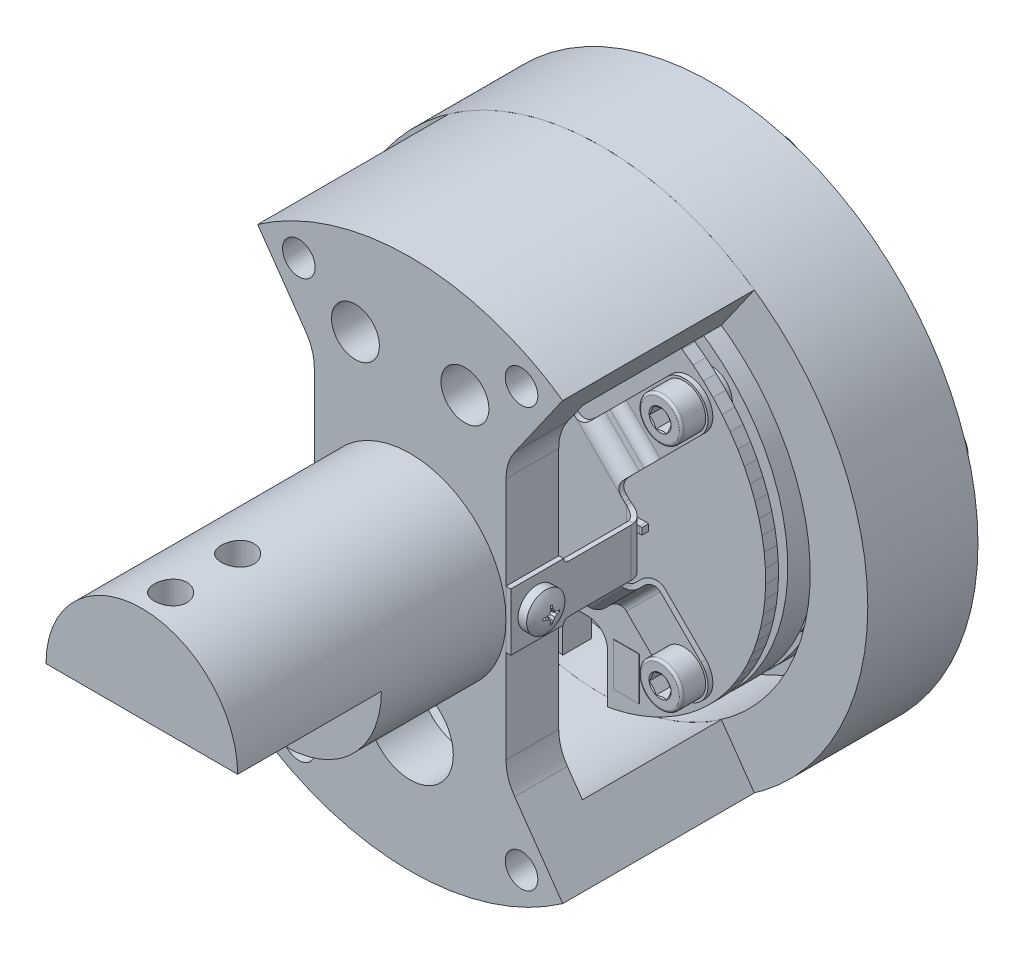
SolidWorks part; units mm, degrees
ref_plane "Plan de face" through (0, 0, 0) normal (0, 0, 1) x (1, 0, 0)
ref_plane "Plan de dessus" through (0, 0, 0) normal (0, 1, 0) x (1, 0, 0)
ref_plane "Plan de droite" through (0, 0, 0) normal (1, 0, 0) x (0, 0, -1)
imported_body "Importée1"
imported_body "Importée2"
imported_body "Importée3"
imported_body "Importée4"
imported_body "Importée5"
imported_body "Importée6"
imported_body "Importée7"
imported_body "Importée8"
imported_body "Importée9"
imported_body "Importée10"
imported_body "Importée11"
imported_body "Importée12"
imported_body "Importée13"
imported_body "Importée14"
imported_body "Importée15"
imported_body "Importée16"
imported_body "Importée17"
imported_body "Importée18"
imported_body "Importée19"
imported_body "Importée20"
imported_body "Importée21"
imported_body "Importée22"
imported_body "Importée23"
imported_body "Importée24"
imported_body "Importée25"
imported_body "Importée26"
imported_body "Importée27"
imported_body "Importée28"
imported_body "Importée29"
imported_body "Importée30"
imported_body "Importée31"
imported_body "Importée32"
imported_body "Importée33"
imported_body "Importée34"
imported_body "Importée35"
imported_body "Importée36"
imported_body "Importée37"
imported_body "Importée38"
imported_body "Importée39"
imported_body "Importée40"
imported_body "Importée41"
imported_body "Importée42"
imported_body "Importée43"
imported_body "Importée44"
imported_body "Importée45"
imported_body "Importée46"
imported_body "Importée47"
imported_body "Importée48"
imported_body "Importée49"
imported_body "Importée50"
imported_body "Importée51"
imported_body "Importée52"
imported_body "Importée53"
imported_body "Importée54"
imported_body "Importée55"
imported_body "Importée56"
imported_body "Importée57"
imported_body "Importée58"
imported_body "Importée59"
imported_body "Importée60"
imported_body "Importée61"
imported_body "Importée62"
imported_body "Importée63"
imported_body "Importée64"
imported_body "Importée65"
imported_body "Importée66"
imported_body "Importée67"
imported_body "Importée68"
imported_body "Importée69"
imported_body "Importée70"
imported_body "Importée71"
imported_body "Importée72"
imported_body "Importée73"
imported_body "Importée74"
imported_body "Importée75"
imported_body "Importée76"
imported_body "Importée77"
imported_body "Importée78"
imported_body "Importée79"
imported_body "Importée80"
imported_body "Importée81"
imported_body "Importée82"
imported_body "Importée83"
imported_body "Importée84"
imported_body "Importée85"
imported_body "Importée86"
imported_body "Importée87"
imported_body "Importée88"
imported_body "Importée89"
imported_body "Importée90"
imported_body "Importée91"
imported_body "Importée92"
imported_body "Importée93"
imported_body "Importée94"
imported_body "Importée95"
imported_body "Importée96"
imported_body "Importée97"
imported_body "Importée98"
imported_body "Importée99"
imported_body "Importée100"
imported_body "Importée101"
imported_body "Importée102"
imported_body "Importée103"
imported_body "Importée104"
imported_body "Importée105"
imported_body "Importée106"
imported_body "Importée107"
imported_body "Importée108"
imported_body "Importée109"
imported_body "Importée110"
imported_body "Importée111"
imported_body "Importée112"
imported_body "Importée113"
imported_body "Importée114"
imported_body "Importée115"
imported_body "Importée116"
imported_body "Importée117"
imported_body "Importée118"
imported_body "Importée119"
imported_body "Importée120"
imported_body "Importée121"
imported_body "Importée122"
imported_body "Importée123"
imported_body "Importée124"
imported_body "Importée125"
sketch "Esquisse1" plane through (0, 0, 0) normal (0, -1, 0) x (1, 0, 0)
  circle A0 centre (0, 64.1) radius 1.7 construction
  circle A1 centre (0, 64.1) radius 1.7
  circle A2 centre (0, 57.1) radius 1.7 construction
  circle A3 centre (0, 57.1) radius 1.7
extrude "Enlèv. mat.-Extru.1" cut sketch "Esquisse1" against normal through all
